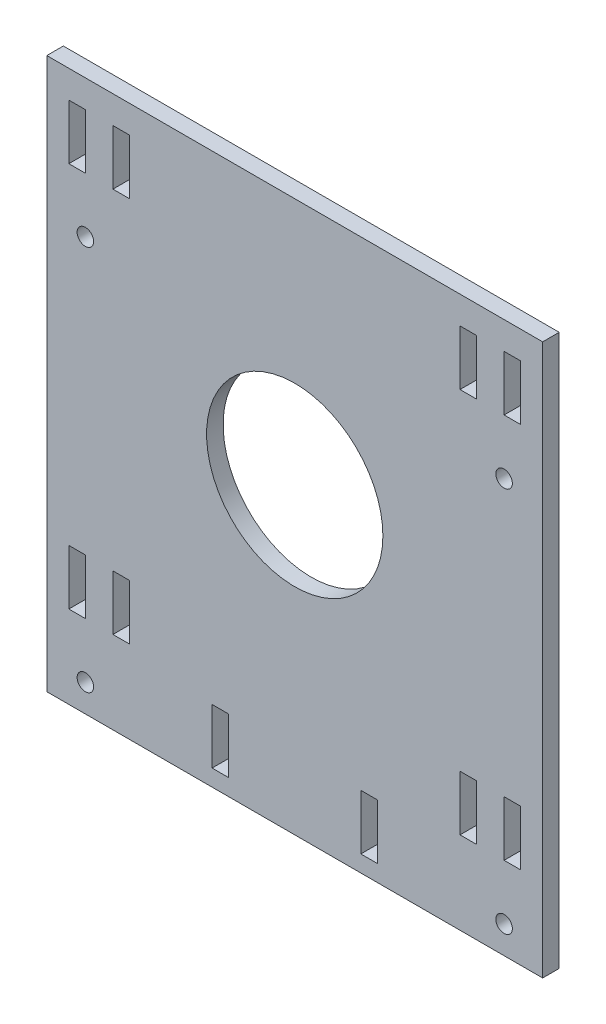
SolidWorks part; units mm, degrees
ref_plane "前视基准面" through (0, 0, 0) normal (0, 0, 1) x (1, 0, 0)
ref_plane "上视基准面" through (0, 0, 0) normal (0, 1, 0) x (1, 0, 0)
ref_plane "右视基准面" through (0, 0, 0) normal (1, 0, 0) x (0, 0, -1)
sketch "草图1" plane through (0, 0, 0) normal (0, 0, 1) x (1, 0, 0)
  line L0 (0, 0) -> (-23.7764, 7.7254) construction
  circle A0 centre (0, 0) radius 12.5
  circle A1 centre (0, 25) radius 12.5
  circle A2 centre (23.7764, 7.7254) radius 12.5
  circle A3 centre (14.6946, -20.2254) radius 12.5
  circle A4 centre (-14.6946, -20.2254) radius 12.5
  circle A5 centre (-23.7764, 7.7254) radius 12.5
  circle A6 centre (-23.7764, 7.7254) radius 10.5
  circle A7 centre (0, 25) radius 10.5
  circle A8 centre (23.7764, 7.7254) radius 10.5
  circle A9 centre (-14.6946, -20.2254) radius 10.5
  circle A10 centre (14.6946, -20.2254) radius 10.5
  circle A11 centre (-23.7764, 7.7254) radius 9
  circle A12 centre (0, 25) radius 9
  circle A13 centre (23.7764, 7.7254) radius 9
  circle A14 centre (14.6946, -20.2254) radius 9
  circle A15 centre (-14.6946, -20.2254) radius 9
  circle A17 centre (0, 0) radius 35.5
  point P16 (0, 0)
  dimension "D1" = 25
  dimension "D2" = 25
  dimension "D4" = 21
  dimension "D5" = 21
  dimension "D6" = 21
  dimension "D7" = 21
  dimension "D8" = 18
  dimension "D11" = 21
  dimension "D3" = 5
  dimension "D10" = 25
  dimension "D9" = 5
sketch "草图2" plane through (0, 0, 0) normal (0, 0, 1) x (1, 0, 0)
  line L0 (-10.5, 25) -> (-10.5, 27.9643)
  line L1 (10.5, 25) -> (10.5, 27.9643)
  line L2 (20.5317, 17.7115) -> (23.3509, 18.6275)
  line L3 (27.0211, -2.2607) -> (29.8403, -1.3447)
  line L4 (23.1893, -14.0537) -> (24.9317, -16.4518)
  line L5 (6.2, -26.3972) -> (7.9423, -28.7953)
  line L6 (-6.2, -26.3972) -> (-7.9423, -28.7953)
  line L7 (-23.1893, -14.0537) -> (-24.9317, -16.4518)
  line L8 (-27.0211, -2.2607) -> (-29.8403, -1.3447)
  line L9 (-20.5317, 17.7115) -> (-23.3509, 18.6275)
  line L11 (0, 0) -> (27.0211, -2.2607) construction
  circle A0 centre (14.6946, -20.2254) radius 10.5 construction
  circle A1 centre (-14.6946, -20.2254) radius 10.5 construction
  circle A2 centre (23.7764, 7.7254) radius 10.5 construction
  circle A3 centre (0, 25) radius 10.5 construction
  circle A4 centre (-23.7764, 7.7254) radius 10.5 construction
  circle A5 centre (0, 0) radius 35.5 construction
  arc A6 (23.1893, -14.0537) -> (6.2, -26.3972) centre (14.6946, -20.2254) ccw
  arc A7 (-6.2, -26.3972) -> (-23.1893, -14.0537) centre (-14.6946, -20.2254) ccw
  arc A8 (20.5317, 17.7115) -> (27.0211, -2.2607) centre (23.7764, 7.7254) ccw
  arc A9 (-10.5, 25) -> (10.5, 25) centre (0, 25) ccw
  arc A10 (-27.0211, -2.2607) -> (-20.5317, 17.7115) centre (-23.7764, 7.7254) ccw
  arc A11 (-16.3413, 31.5153) -> (-24.9231, 25.2802) centre (0, 0) ccw
  arc A12 (-35.0225, -5.8027) -> (-31.7446, -15.8912) centre (0, 0) ccw
  arc A13 (24.9231, 25.2802) -> (16.3413, 31.5153) centre (0, 0) ccw
  arc A14 (31.7446, -15.8912) -> (35.0225, -5.8027) centre (0, 0) ccw
  arc A15 (-5.3039, -35.1016) -> (5.3039, -35.1016) centre (0, 0) ccw
  arc A16 (23.3509, 18.6275) -> (24.9231, 25.2802) centre (22.1148, 22.4318) ccw
  arc A17 (10.5, 27.9643) -> (16.3413, 31.5153) centre (14.5, 27.9643) cw
  arc A18 (-10.5, 27.9643) -> (-16.3413, 31.5153) centre (-14.5, 27.9643) ccw
  arc A19 (-23.3509, 18.6275) -> (-24.9231, 25.2802) centre (-22.1148, 22.4318) cw
  arc A20 (24.9317, -16.4518) -> (31.7446, -15.8912) centre (28.1677, -14.1007) ccw
  arc A21 (7.9423, -28.7953) -> (5.3039, -35.1016) centre (4.7062, -31.1465) cw
  arc A22 (-7.9423, -28.7953) -> (-5.3039, -35.1016) centre (-4.7062, -31.1465) ccw
  arc A23 (-24.9317, -16.4518) -> (-31.7446, -15.8912) centre (-28.1677, -14.1007) cw
  arc A24 (-35.0225, -5.8027) -> (-29.8403, -1.3447) centre (-31.0763, -5.1489) cw
  arc A25 (29.8403, -1.3447) -> (35.0225, -5.8027) centre (31.0763, -5.1489) cw
  dimension "D2" = 4
  dimension "D3" = 4
  dimension "D1" = 5
sketch "草图3" plane through (0, 0, 0) normal (0, 0, 1) x (1, 0, 0)
  line L0 (-45, 45) -> (45, 45)
  line L1 (45, 45) -> (45, -45)
  line L3 (-45, -45) -> (-45, 45)
  line L4 (-45, -45) -> (-45, -55)
  line L7 (-45, -55) -> (45, -55)
  line L8 (45, -45) -> (45, -55)
  circle A16 centre (0, 0) radius 16
  dimension "D4" = 32
  dimension "D1" = 90
  dimension "D2" = 90
  dimension "D3" = 10
extrude "凸台-拉伸2" add sketch "草图3" along normal blind 3
sketch "草图4" plane through (0, 0, 3) normal (0, 0, 1) x (1, 0, 0)
  circle A0 centre (0, 0) radius 13.5
sketch "草图5" plane through (0, 0, 3) normal (0, 0, 1) x (1, 0, 0)
  line L0 (-33, 40) -> (-33, 30)
  line L1 (-33, 30) -> (-30, 30)
  line L2 (-30, 30) -> (-30, 40)
  line L3 (-30, 40) -> (-33, 40)
  line L4 (30, 40) -> (30, 30)
  line L5 (30, 30) -> (33, 30)
  line L6 (33, 30) -> (33, 40)
  line L7 (33, 40) -> (30, 40)
  line L8 (-33, -30) -> (-33, -40)
  line L9 (-33, -40) -> (-30, -40)
  line L10 (-30, -40) -> (-30, -30)
  line L11 (-30, -30) -> (-33, -30)
  line L12 (30, -30) -> (30, -40)
  line L13 (30, -40) -> (33, -40)
  line L14 (33, -40) -> (33, -30)
  line L15 (33, -30) -> (30, -30)
  line L16 (0, 45) -> (0, -54.353) construction
  line L17 (-45, 45) -> (45, 45) construction
  line L18 (-45, 0) -> (45, 0) construction
  line L19 (-45, -55) -> (-45, 45) construction
  line L20 (45, -55) -> (45, 45) construction
  dimension "D1" = 3
  dimension "D2" = 10
  dimension "D3" = 10
  dimension "D4" = 3
  dimension "D5" = 10
  dimension "D6" = 3
  dimension "D7" = 3
  dimension "D8" = 10
  dimension "D9" = 30
  dimension "D10" = 30
  dimension "D11" = 30
  dimension "D12" = 30
  dimension "D13" = 30
  dimension "D14" = 30
  dimension "D15" = 30
  dimension "D16" = 30
extrude "切除-拉伸2" cut sketch "草图5" against normal through all
sketch "草图6" plane through (0, 0, 3) normal (0, 0, 1) x (1, 0, 0)
  line L0 (-38, -30) -> (-38, -40)
  line L1 (-38, -40) -> (-41, -40)
  line L2 (-41, -40) -> (-41, -30)
  line L3 (-41, -30) -> (-38, -30)
  line L4 (-33, -30) -> (-33, -40) construction
  line L5 (-30, -30) -> (-33, -30) construction
  line L6 (-41, 40) -> (-41, 30)
  line L7 (-41, 30) -> (-38, 30)
  line L8 (-38, 30) -> (-38, 40)
  line L9 (-38, 40) -> (-41, 40)
  line L11 (-45, 45) -> (45, 45) construction
  line L16 (-15, -42) -> (-15, -52)
  line L17 (-15, -52) -> (-12, -52)
  line L18 (-12, -52) -> (-12, -42)
  line L19 (-15, -42) -> (-12, -42)
  line L20 (0, 45) -> (0, -55.2023) construction
  line L21 (15, -42) -> (12, -42)
  line L22 (12, -52) -> (12, -42)
  line L23 (15, -52) -> (12, -52)
  line L24 (15, -42) -> (15, -52)
  line L25 (38, 40) -> (41, 40)
  line L26 (38, 30) -> (38, 40)
  line L27 (41, 30) -> (38, 30)
  line L28 (41, 40) -> (41, 30)
  line L29 (41, -30) -> (38, -30)
  line L30 (41, -40) -> (41, -30)
  line L31 (38, -40) -> (41, -40)
  line L32 (38, -30) -> (38, -40)
  line L33 (-45, -55) -> (45, -55) construction
  circle A0 centre (-38, -50) radius 1.5
  circle A1 centre (-38, 20) radius 1.5
  circle A2 centre (38, 20) radius 1.5
  circle A3 centre (38, -50) radius 1.5
  dimension "D7" = 25
  dimension "D8" = 3
  dimension "D9" = 3
  dimension "D10" = 5
  dimension "D1" = 5
  dimension "D2" = 3
  dimension "D3" = 10
  dimension "D4" = 10
  dimension "D5" = 5
  dimension "D6" = 3
  dimension "D11" = 3
  dimension "D12" = 10
  dimension "D13" = 3
  dimension "D14" = 12
extrude "切除-拉伸3" cut sketch "草图6" against normal blind 10
